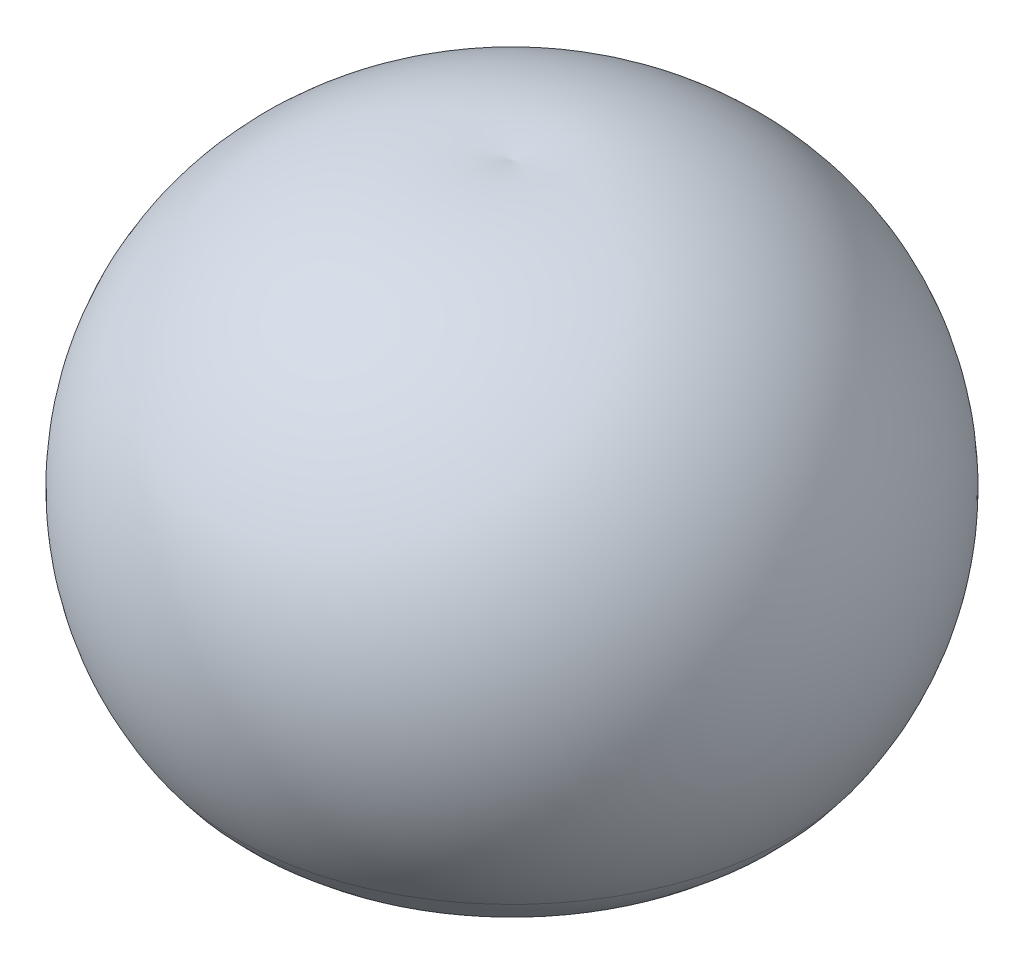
SolidWorks part; units mm, degrees
ref_plane "Frontale" through (0, 0, 0) normal (0, 0, 1) x (1, 0, 0)
ref_plane "Superiore" through (0, 0, 0) normal (0, 1, 0) x (1, 0, 0)
ref_plane "Destro" through (0, 0, 0) normal (1, 0, 0) x (0, 0, -1)
sketch "Pos.7 (calibrazione)" plane through (0, 0, 0) normal (0, 0, 1) x (1, 0, 0)
  line L0 (0, 0) -> (0, 550) construction
  line L1 (0, 550) -> (-400, 550) construction
  line L2 (-400, 550) -> (-400, 1800) construction
  line L3 (-400, 1800) -> (-400, 2010) construction
  line L4 (-400, 2010) -> (-1842.8, 2010) construction
  line L5 (-1842.8, 2010) -> (-400, 1800) construction
  line L9 (-400, 1800) -> (-190, 1800) construction
  line L10 (-400, 550) -> (-400, 340) construction
  dimension "D1" = 550
  dimension "D2" = 400
  dimension "D3" = 210
  dimension "D4" = 1250
  dimension "D5" = 90
  dimension "D6" = 1442.8
  dimension "D7" = 1458.0027
  dimension "D8" = 2010
  dimension "D9" = 1842.8
sketch "Pos.1" plane through (0, 0, 0) normal (0, 0, 1) x (1, 0, 0)
  line L0 (-400, 550) -> (-1423.9401, 1266.9705) construction
  line L1 (-400, 550) -> (-400, 965.154) construction
  line L2 (-1423.9401, 1266.9705) -> (-1572.4325, 1118.4781) construction
  line L8 (-400, 1800) -> (-400, 2010) construction
  line L10 (-400, 550) -> (-400, 1800) construction
  line L11 (-1572.4325, 1118.4781) -> (-552.2188, 98.2645) construction
  line L13 (0, 550) -> (-400, 550) construction
  line L14 (0, 0) -> (0, 550) construction
  line L15 (0, 0) -> (0, 550) construction
  line L16 (0, 550) -> (-400, 550) construction
  line L17 (-552.2188, 98.2645) -> (-1423.9401, 1266.9705) construction
  line L18 (-400, 2010) -> (-1842.8, 2010) construction
  line L19 (-1423.9401, 1266.9705) -> (-1572.4325, 1415.463) construction
  dimension "D1" = 55
  dimension "D2" = 170
  dimension "D4" = 98.2645
  dimension "D7" = 552.2188
sketch "Pos.1-2" plane through (0, 0, 0) normal (0, 0, 1) x (1, 0, 0)
  line L0 (0, 0) -> (0, 550) construction
  line L1 (0, 550) -> (-400, 550) construction
  line L2 (-400, 550) -> (-1645.2434, 441.0553) construction
  line L3 (-1645.2434, 441.0553) -> (-1725.6069, 247.0406) construction
  line L4 (-1725.6069, 247.0406) -> (-392.6335, -305.095) construction
  line L5 (-392.6335, -305.095) -> (-1645.2434, 441.0553) construction
  line L6 (-400, 550) -> (-1423.9401, 1266.9705) construction
  line L7 (-1423.9401, 1266.9705) -> (-1572.4325, 1118.4781) construction
  line L8 (-552.2188, 98.2645) -> (-1423.9401, 1266.9705) construction
  line L10 (-400, 550) -> (-400, 965.154) construction
  line L11 (-1645.2434, 441.0553) -> (-1839.2581, 521.4188) construction
  dimension "D1" = 95
  dimension "D2" = 152.5
sketch "Pos.2" plane through (0, 0, 0) normal (0, 0, 1) x (1, 0, 0)
  line L0 (0, 0) -> (0, 550) construction
  line L1 (0, 550) -> (-400, 550) construction
  line L2 (-400, 550) -> (-1423.9401, -166.9705) construction
  line L7 (-1423.9401, -166.9705) -> (-1442.2428, -376.1714) construction
  line L8 (-1442.2428, -376.1714) -> (-4.9331, -501.9197) construction
  line L9 (-4.9331, -501.9197) -> (-1423.9401, -166.9705) construction
  line L10 (-1423.9401, 1266.9705) -> (-1572.4325, 1118.4781) construction
  line L11 (-400, 550) -> (-400, 340) construction
  line L13 (-400, 550) -> (-400, 340) construction
  line L15 (-1572.4325, 1118.4781) -> (-552.2188, 98.2645) construction
  line L16 (-400, 550) -> (-400, 1800) construction
  line L17 (-1423.9401, -166.9705) -> (-1633.1409, -148.6678) construction
  dimension "D1" = 125
  dimension "D2" = 140
  dimension "D3" = 501.9197
  dimension "D4" = 4.9331
sketch "Pos.3" plane through (0, 0, 0) normal (0, 0, 1) x (1, 0, 0)
  line L0 (0, 0) -> (0, 550) construction
  line L1 (0, 550) -> (-400, 550) construction
  line L5 (-1423.9401, -166.9705) -> (-400, 550) construction
  line L7 (-1423.9401, -166.9705) -> (-1567.9119, -14.0912) construction
  line L8 (-1567.9119, -14.0912) -> (-2618.2659, -1003.2465) construction
  line L9 (-2618.2659, -1003.2465) -> (-1423.9401, -166.9705) construction
  line L10 (-1423.9401, -166.9705) -> (-1442.2428, -376.1714) construction
  line L11 (-1442.2428, -376.1714) -> (-4.9331, -501.9197) construction
  line L12 (-400, 550) -> (-400, 1800) construction
  line L13 (-400, 550) -> (-400, 760) construction
  line L14 (-1423.9401, -166.9705) -> (-1271.0607, -22.9987) construction
  dimension "D1" = 125
  dimension "D2" = 8.281
  dimension "D3" = 1003.2465
  dimension "D4" = 2618.2659
sketch "Pos.4" plane through (0, 0, 0) normal (0, 0, 1) x (1, 0, 0)
  line L0 (0, 0) -> (0, 550) construction
  line L1 (0, 550) -> (-400, 550) construction
  line L4 (-15.1274, 1518.9929) -> (27.5252, 1724.6158) construction
  line L5 (27.5252, 1724.6158) -> (-400, 550) construction
  line L7 (-400, 550) -> (-400, 760) construction
  line L8 (27.5252, 1724.6158) -> (233.148, 1681.9632) construction
  line L9 (233.148, 1681.9632) -> (526.1915, 3094.6901) construction
  line L10 (526.1915, 3094.6901) -> (27.5252, 1724.6158) construction
  line L11 (-1423.9401, -166.9705) -> (-1567.9119, -14.0912) construction
  line L12 (-1567.9119, -14.0912) -> (-2618.2659, -1003.2465) construction
  line L13 (-400, 550) -> (-400, 1800) construction
  dimension "D1" = 20
  dimension "D2" = 8.281
  dimension "D3" = 11.719
  dimension "D4" = 526.1915
  dimension "D5" = 3094.6901
sketch "Pos.4-5" plane through (0, 0, 0) normal (0, 0, 1) x (1, 0, 0)
  line L0 (0, 0) -> (0, 550) construction
  line L1 (0, 550) -> (-400, 550) construction
  line L2 (-400, 550) -> (-400, 760) construction
  line L3 (-400, 550) -> (403.4845, 1507.5556) construction
  line L4 (403.4845, 1507.5556) -> (611.5166, 1478.8737) construction
  line L5 (611.5166, 1478.8737) -> (808.5744, 2908.1533) construction
  line L6 (808.5744, 2908.1533) -> (403.4845, 1507.5556) construction
  line L7 (403.4845, 1507.5556) -> (343.5203, 1072.629) construction
  line L8 (526.1915, 3094.6901) -> (27.5252, 1724.6158) construction
  line L9 (233.148, 1681.9632) -> (526.1915, 3094.6901) construction
  line L10 (27.5252, 1724.6158) -> (233.148, 1681.9632) construction
  line L11 (27.5252, 1724.6158) -> (-400, 550) construction
  dimension "D1" = 40
  dimension "D2" = 32.15
sketch "Pos.5" plane through (0, 0, 0) normal (0, 0, 1) x (1, 0, 0)
  line L0 (0, 0) -> (0, 550) construction
  line L1 (0, 550) -> (-400, 550) construction
  line L2 (-400, 550) -> (682.5318, 1175) construction
  line L3 (682.5318, 1175) -> (653.8499, 966.9679) construction
  line L4 (-400, 550) -> (-400, 1800) construction
  line L7 (682.5318, 1175) -> (890.5639, 1146.3182) construction
  line L8 (27.5252, 1724.6158) -> (233.148, 1681.9632) construction
  line L9 (890.5639, 1146.3182) -> (1087.6216, 2575.5977) construction
  line L10 (1087.6216, 2575.5977) -> (682.5318, 1175) construction
  line L11 (233.148, 1681.9632) -> (526.1915, 3094.6901) construction
  line L12 (-400, 550) -> (-400, 760) construction
  dimension "D1" = 60
  dimension "D2" = 7.85
  dimension "D8" = 1087.6216
  dimension "D9" = 2575.5977
sketch "Pos.6" plane through (0, 0, 0) normal (0, 0, 1) x (1, 0, 0)
  line L0 (0, 550) -> (-400, 550) construction
  line L1 (0, 0) -> (0, 550) construction
  line L2 (0, 550) -> (-400, 550) construction
  line L3 (0, 0) -> (0, 550) construction
  line L4 (-400, 550) -> (682.5318, 1175) construction
  line L5 (682.5318, 1175) -> (610.7075, 1372.3355) construction
  line L6 (610.7075, 1372.3355) -> (-745.081, 878.8688) construction
  line L7 (-745.081, 878.8688) -> (682.5318, 1175) construction
  line L8 (682.5318, 1175) -> (879.8672, 1246.8242) construction
  line L9 (-400, 550) -> (-400, 1800) construction
  line L10 (-400, 1800) -> (-400, 2010) construction
  line L11 (-1842.8, 2010) -> (-400, 1800) construction
  line L12 (-400, 550) -> (-400, 760) construction
  dimension "D1" = 60
  dimension "D2" = 170
  dimension "D3" = 878.8688
  dimension "D4" = 745.081
sketch "Area Lavoro" plane through (0, 0, 0) normal (0, 0, 1) x (1, 0, 0)
  line L0 (-285.1915, 3258.0027) -> (-400, 3258.0027)
  line L1 (-2618.2659, -1003.2465) -> (-1423.9401, -166.9705) construction
  line L2 (890.5639, 1146.3182) -> (1087.6216, 2575.5977) construction
  line L4 (60.1098, 0) -> (0, 0)
  line L5 (0, 0) -> (0, 38.5848)
  line L6 (1087.6216, 2575.5977) -> (1087.6216, 2488.7833)
  line L7 (-3108.0027, 698.7107) -> (-3108.0027, 550)
  line L8 (-1579.4655, -1624.9732) -> (-1423.9401, -1624.9732)
  line L9 (1087.6216, 2575.5977) -> (1153.6527, 2575.5977)
  arc A5 (-552.2188, 98.2645) -> (-4.9331, -501.9197) centre (60.633, 107.4845) ccw
  arc A6 (-4.9331, -501.9197) -> (-2618.2659, -1003.2465) centre (-1423.9401, -166.9705) cw
  arc A7 (-2618.2659, -1003.2465) -> (526.1915, 3094.6901) centre (-400, 550) cw
  arc A8 (526.1915, 3094.6901) -> (1087.6216, 2575.5977) centre (-66.3955, 1890.6144) cw
  arc A9 (-552.2188, 98.2645) -> (-745.081, 878.8688) centre (-400, 550) cw
  arc A11 (1087.6216, 2575.5977) -> (-745.081, 878.8688) centre (682.5318, 1175) ccw
sketch "Schizzo1" plane through (0, 0, 0) normal (0, 0, 1) x (1, 0, 0)
  line L0 (0, 0) -> (0, 3499.3699) construction
  line L1 (0, 3228.2977) -> (0, 2463.3797)
  arc A0 (1087.6216, 2575.5977) -> (-745.081, 878.8688) centre (682.5318, 1175) ccw construction
  arc A1 (-745.081, 878.8688) -> (-552.2188, 98.2645) centre (-400, 550) ccw construction
  arc A2 (-552.2188, 98.2645) -> (-4.9331, -501.9197) centre (60.633, 107.4845) ccw construction
  arc A3 (526.1915, 3094.6901) -> (-2618.2659, -1003.2465) centre (-400, 550) ccw construction
  arc A4 (-2618.2659, -1003.2465) -> (-4.9331, -501.9197) centre (-1423.9401, -166.9705) ccw construction
  arc A5 (0, 2463.3797) -> (-745.081, 878.8688) centre (682.5318, 1175) ccw
  arc A6 (-745.081, 878.8688) -> (-552.2188, 98.2645) centre (-400, 550) ccw
  arc A7 (-552.2188, 98.2645) -> (-4.9331, -501.9197) centre (60.633, 107.4845) ccw
  arc A8 (0, 3228.2977) -> (-2618.2659, -1003.2465) centre (-400, 550) ccw
  arc A9 (-2618.2659, -1003.2465) -> (-4.9331, -501.9197) centre (-1423.9401, -166.9705) ccw
revolve "Rivoluzione1" add sketch "Schizzo1" angle 360 about L0
